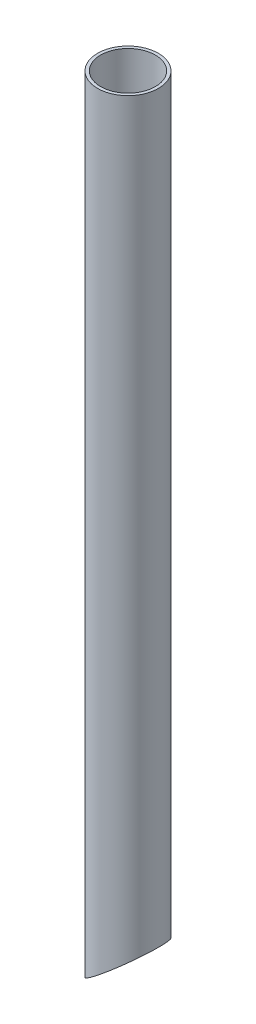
SolidWorks part; units mm, degrees
ref_plane "Vorne" through (0, 0, 0) normal (0, 0, 1) x (1, 0, 0)
ref_plane "Oben" through (0, 0, 0) normal (0, 1, 0) x (1, 0, 0)
ref_plane "Rechts" through (0, 0, 0) normal (1, 0, 0) x (0, 0, -1)
sketch "Skizze1" plane through (0, 0, 0) normal (0, 1, 0) x (1, 0, 0)
  circle A0 centre (0, 0) radius 15
  dimension "D1" = 30
extrude "Linear-Austragen-Dünn1" add sketch "Skizze1" along normal blind 400 thin
sketch "Skizze2" plane through (0, 0, 0) normal (1, 0, 0) x (0, 0, -1)
  line L0 (-15, 0) -> (15, 8.0385)
  line L3 (15, 0) -> (15, 400) construction
  line L4 (-15, 0) -> (15, 0) construction
  dimension "D1" = 15
extrude "Schnitt-Linear austragen1" cut sketch "Skizze2" against normal through all and the other way through all flip side to cut
sketch "Skizze3" plane through (0, -2.8722, 25.719) normal (0, 0.9659, 0.2588) x (1, 0, 0)
  line L0 (0, 42.1555) -> (0, 11.0972) construction
  ellipse E1 centre (0, 26.6263) end of major axis (0, 11.0972) minor radius 15 construction
sketch3d "3D-Skizze1"
  line L0 (-13.9799, 277.1471, -5.4372) -> (13.9799, 295.9821, 5.4372) construction
  line L1 (-360.877, 386.4917, 57.6929) -> (15, 268.0124, -10.7111) construction
  line L2 (-350.6164, 410.9056, 71.7883) -> (25.2606, 292.4263, 3.3843) construction
  line L4 (0, 286.5646, 0) -> (-3.5578, 287.7742, -14.572)
sketch "Skizze4" plane through (0, 0, 0) normal (0, 0, 1) x (1, 0, 0)
  line L0 (0, 59.1997) -> (0, 21.4222) construction
  line L1 (-19.2739, 6.1412) -> (-20.249, -22.2618)
  line L2 (-20.249, -22.2618) -> (18.391, -23.5884)
  line L3 (18.391, -23.5884) -> (18.391, 36.0032)
  line L5 (0, 400) -> (0, 8.0385) construction
  line L6 (0, 21.4222) -> (36.7819, 12.8066) construction
  line L7 (-11.5791, 24.1344) -> (271.1861, -42.0987) construction
  line L8 (-19.2739, 6.1412) -> (18.391, 36.0032)
  line L9 (0, 59.1997) -> (18.391, 36.0032) construction
  line L10 (18.391, 36.0032) -> (36.7819, 12.8066) construction
  dimension "D1" = 18.391
  dimension "D2" = 19.2739
  dimension "D3" = 20.249
  dimension "D4" = 22.2618
extrude "Schnitt-Linear austragen2" cut sketch "Skizze4" against normal through all and the other way through all
move or copy body "Körper-Verschieben/Kopieren1" [suppressed] bodies to move or copy 105
